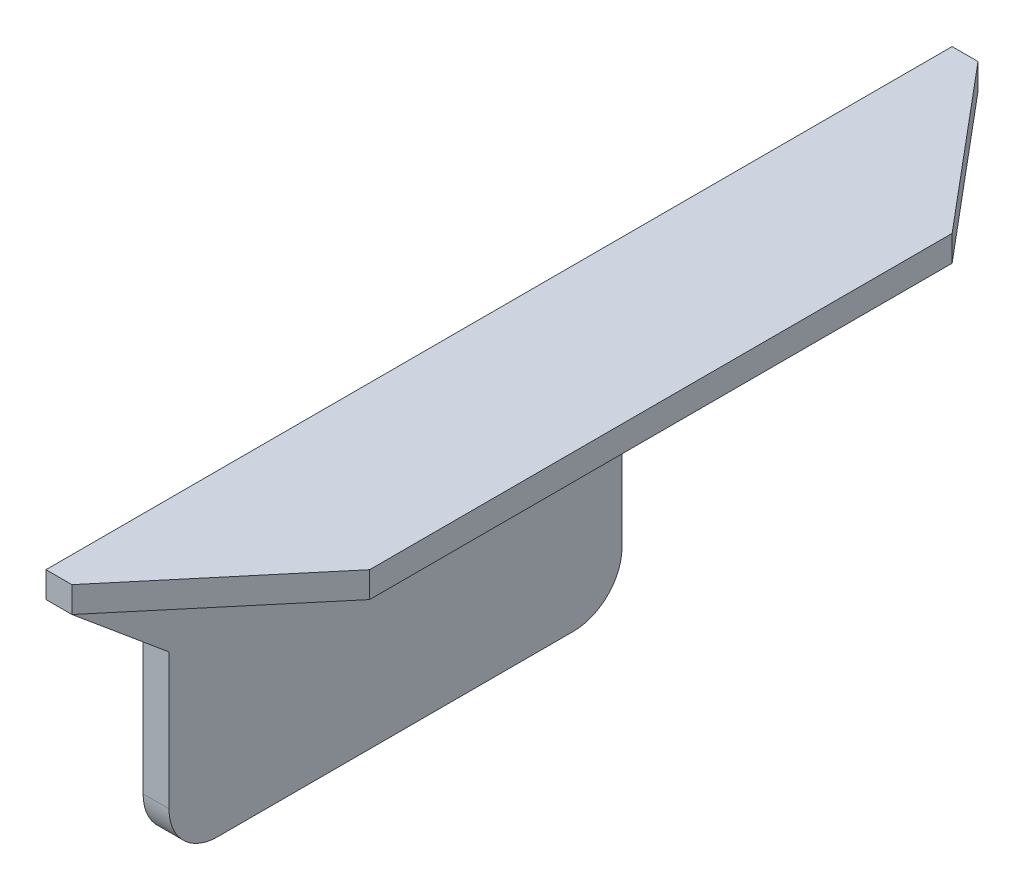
SolidWorks part; units mm, degrees
ref_plane "前视基准面" through (0, 0, 0) normal (0, 0, 1) x (1, 0, 0)
ref_plane "上视基准面" through (0, 0, 0) normal (0, 1, 0) x (1, 0, 0)
ref_plane "右视基准面" through (0, 0, 0) normal (1, 0, 0) x (0, 0, -1)
sketch "草图1" plane through (0, 0, 0) normal (0, 0, 1) x (1, 0, 0)
  line L0 (50, 0) -> (0, 0)
  line L1 (0, 0) -> (0, -90)
  line L2 (0, -90) -> (8, -90)
  line L3 (8, -90) -> (8, -8)
  line L4 (8, -8) -> (50, -8)
  line L5 (50, -8) -> (50, 0)
  dimension "D1" = 8
  dimension "D2" = 8
  dimension "D3" = 50
  dimension "D4" = 90
  dimension "D5" = 8
extrude "拉伸1" add sketch "草图1" along normal blind 280
sketch "草图2" plane through (8, 0, 0) normal (1, 0, 0) x (0, 0, -1)
  line L0 (-280, -8) -> (-250, -33)
  line L1 (-280, -90) -> (0, -90) construction
  line L2 (-235, -90) -> (-125, -90)
  line L3 (-110, -75) -> (-110, -33)
  line L4 (-110, -33) -> (-40, -33)
  line L5 (-40, -33) -> (0, -8)
  line L6 (0, -8) -> (-280, -8)
  line L7 (-250, -33) -> (-250, -75)
  line L8 (-280, -90) -> (-280, -8) construction
  arc A0 (-250, -75) -> (-235, -90) centre (-235, -75) ccw
  arc A1 (-125, -90) -> (-110, -75) centre (-125, -75) ccw
  point P15 (-250, -90)
  point P18 (-110, -90)
  dimension "D7" = 15
  dimension "D1" = 57
  dimension "D2" = 30
  dimension "D3" = 140
  dimension "D4" = 57
  dimension "D5" = 70
extrude "切除-拉伸1" cut sketch "草图2" against normal through all contours A0 L7 L0 M12 M13 | A1 L5 L4 L3 M13 M10
sketch "草图3" plane through (0, -8, 0) normal (0, -1, 0) x (1, 0, 0)
  line L0 (8, 280) -> (50, 230)
  line L1 (50, 280) -> (50, 0) construction
  line L2 (50, 230) -> (50, 50)
  line L3 (50, 50) -> (8, 0)
  line L4 (8, 0) -> (8, 280)
  line L5 (8, 280) -> (50, 280) construction
  dimension "D1" = 50
  dimension "D2" = 180
extrude "切除-拉伸2" cut sketch "草图3" against normal blind 280 contours L0 M7 M6 | L3 M6 M5
